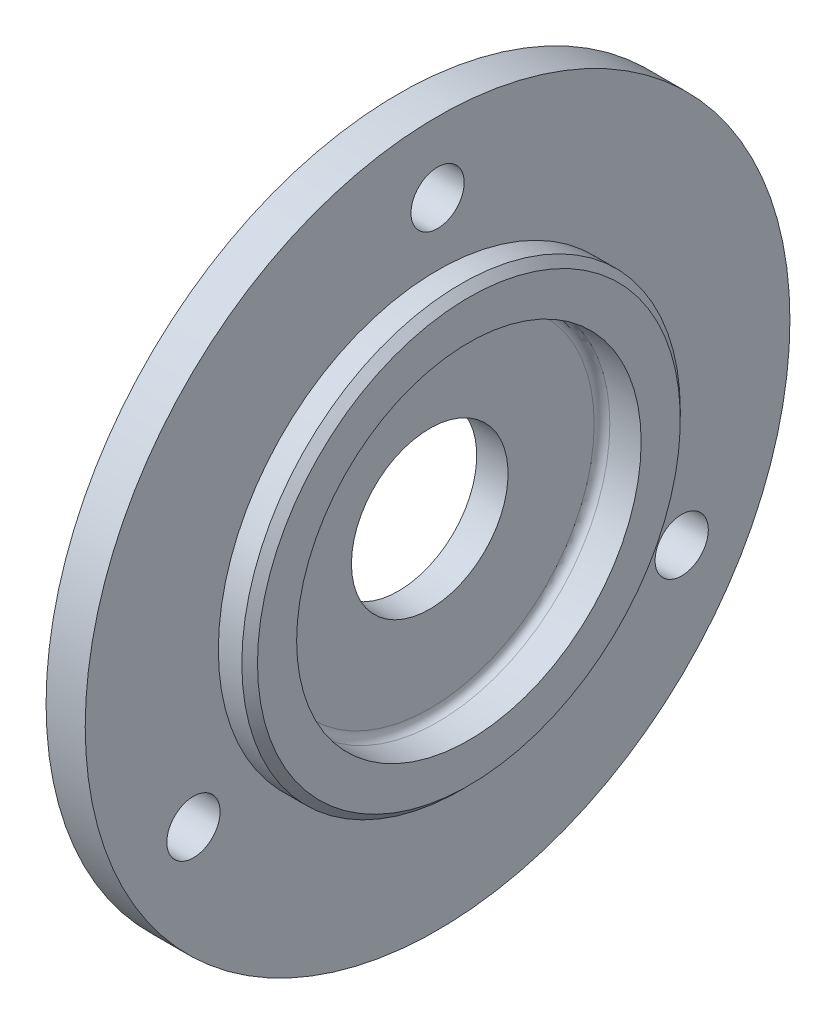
SolidWorks part; units mm, degrees
ref_plane "Plan de face" through (0, 0, 0) normal (0, 0, 1) x (1, 0, 0)
ref_plane "Plan de dessus" through (0, 0, 0) normal (0, 1, 0) x (1, 0, 0)
ref_plane "Plan de droite" through (0, 0, 0) normal (1, 0, 0) x (0, 0, -1)
sketch "Esquisse1" plane through (0, 0, 0) normal (0, 0, 1) x (1, 0, 0)
  line L0 (-14.7778, 0) -> (22.3469, 0) construction
  line L1 (-0.5, 5) -> (-0.5, 10.5)
  line L2 (0, 11) -> (2, 11)
  line L3 (2, 11) -> (2, 13.5)
  line L4 (1.5, 14) -> (0, 14)
  line L5 (0, 14) -> (0, 22.5)
  line L6 (0, 22.5) -> (-2.5, 22.5)
  line L7 (-2.5, 22.5) -> (-2.5, 5)
  line L8 (-2.5, 5) -> (-0.5, 5)
  line L9 (2, 13.5) -> (1.5, 14)
  arc A0 (-0.5, 10.5) -> (0, 11) centre (0, 10.5) cw
  point P7 (2, 14)
  dimension "D8" = 0.5
  dimension "D1" = 10
  dimension "D2" = 28
  dimension "D3" = 22
  dimension "D4" = 45
  dimension "D5" = 2.5
  dimension "D6" = 2
  dimension "D7" = 2
  dimension "D11" = 0.5
revolve "Révolution1" add sketch "Esquisse1" angle 360 about L0
sketch "Esquisse2" plane through (0, 0, 0) normal (1, 0, 0) x (0, 0, -1)
  circle A0 centre (0, 18) radius 1.7
  circle A1 centre (15.5885, -9) radius 1.7
  circle A2 centre (-15.5885, -9) radius 1.7
  dimension "D1" = 3.4
  dimension "D2" = 18
extrude "Enlèv. mat.-Extru.1" cut sketch "Esquisse2" against normal blind 10
